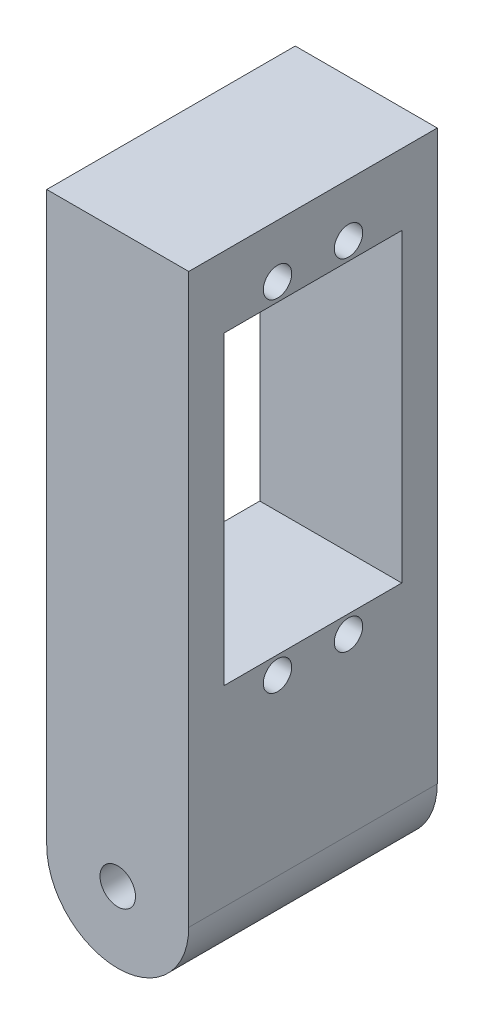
SolidWorks part; units mm, degrees
ref_plane "Front Plane" through (0, 0, 0) normal (0, 0, 1) x (1, 0, 0)
ref_plane "Top Plane" through (0, 0, 0) normal (0, 1, 0) x (1, 0, 0)
ref_plane "Right Plane" through (0, 0, 0) normal (1, 0, 0) x (0, 0, -1)
sketch "Sketch2" plane through (0, 0, 0) normal (0, 0, 1) x (1, 0, 0)
  line L0 (0, 0) -> (20, 0)
  line L1 (20, 0) -> (20, -80)
  line L3 (0, -80) -> (0, 0)
  arc A0 (0, -80) -> (20, -80) centre (10, -80) ccw
  circle A1 centre (10, -80) radius 2.5
  dimension "D3" = 20
  dimension "D4" = 5
  dimension "D1" = 80
  dimension "D2" = 20
extrude "Boss-Extrude1" add sketch "Sketch2" along normal blind 35
sketch "Sketch3" plane through (0, 0, 0) normal (-1, 0, 0) x (0, 0, 1)
  line L1 (35, 0) -> (0, 0) construction
  line L3 (0, 0) -> (0, -80) construction
  line L4 (30, -10) -> (30, -53)
  line L5 (30, -53) -> (5, -53)
  line L6 (5, -53) -> (5, -10)
  line L7 (5, -10) -> (30, -10)
  circle A0 centre (12.5, -7.5) radius 2
  circle A1 centre (22.5, -7.5) radius 2
  circle A2 centre (22.5, -55.5) radius 2
  circle A3 centre (12.5, -55.5) radius 2
  point P22 (0, 0)
  dimension "D12" = 4
  dimension "D14" = 4
  dimension "D16" = 4
  dimension "D17" = 4
  dimension "D1" = 25
  dimension "D2" = 43
  dimension "D3" = 5
  dimension "D5" = 10
extrude "Cut-Extrude2" cut sketch "Sketch3" against normal blind 35
